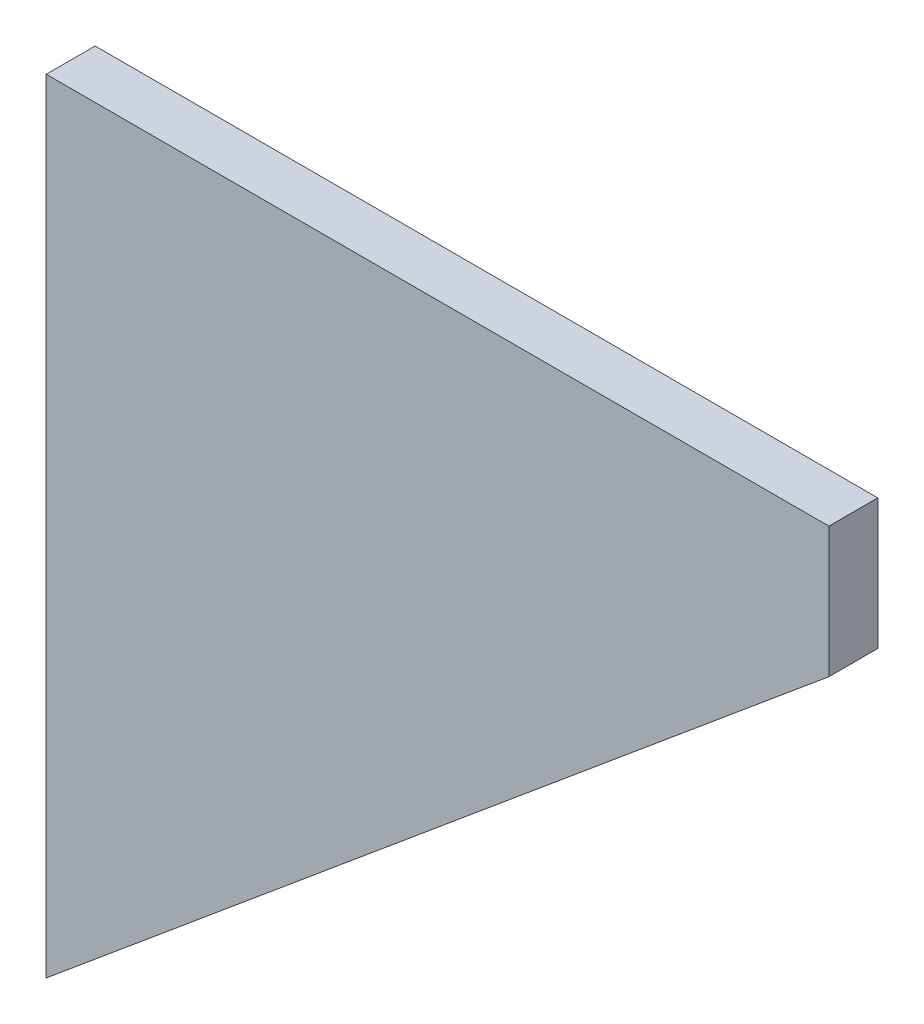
SolidWorks part; units mm, degrees
ref_plane "Front Plane" through (0, 0, 0) normal (0, 0, 1) x (1, 0, 0)
ref_plane "Top Plane" through (0, 0, 0) normal (0, 1, 0) x (1, 0, 0)
ref_plane "Right Plane" through (0, 0, 0) normal (1, 0, 0) x (0, 0, -1)
sketch "Sketch1" plane through (0, 0, 0) normal (0, 0, 1) x (1, 0, 0)
  line L0 (0, 0) -> (0, -152.4)
  line L1 (0, 0) -> (152.4, 0)
  line L2 (152.4, 0) -> (152.4, -25.4)
  line L3 (152.4, -25.4) -> (0, -152.4)
  dimension "D1" = 152.4
  dimension "D2" = 152.4
  dimension "D3" = 25.4
extrude "Extrude1" add sketch "Sketch1" along normal blind 9.525
